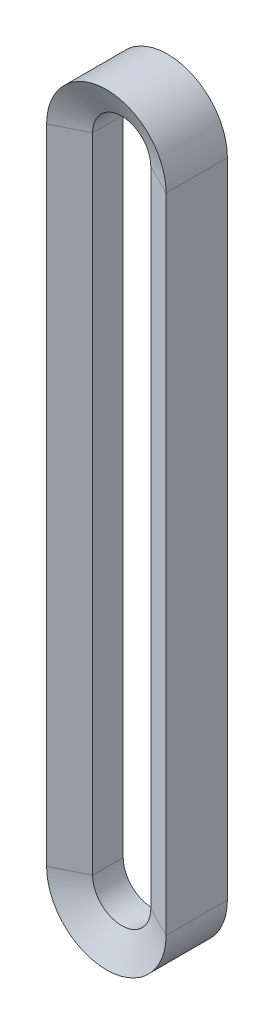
SolidWorks part; units mm, degrees
ref_plane "Front Plane" through (0, 0, 0) normal (0, 0, 1) x (1, 0, 0)
ref_plane "Top Plane" through (0, 0, 0) normal (0, 1, 0) x (1, 0, 0)
ref_plane "Right Plane" through (0, 0, 0) normal (1, 0, 0) x (0, 0, -1)
sketch "Sketch2" plane through (0, 0, 0) normal (0, 0, 1) x (1, 0, 0)
  line L0 (0, 0) -> (1, 0) construction
  line L1 (0, 0) -> (0, 1) construction
  line L2 (12.065, 0) -> (12.065, -266.4821)
  line L3 (-12.065, -266.4821) -> (-12.065, 0)
  arc A0 (-12.065, 0) -> (12.065, 0) centre (0, 0) cw
  arc A1 (12.065, -266.4821) -> (-12.065, -266.4821) centre (0, -266.4821) cw
sketch "Sketch3" plane through (0, 0, 0) normal (0, 1, 0) x (1, 0, 0)
  line L0 (12.065, -6.35) -> (12.065, 6.35)
  line L1 (12.065, 6.35) -> (24.765, 12.7)
  line L2 (24.765, 12.7) -> (24.765, -12.7)
  line L3 (24.765, -12.7) -> (12.065, -6.35)
  line L4 (-12.065, 0) -> (12.065, 0) construction
  dimension "D1" = 12.7
  dimension "D2" = 25.4
  dimension "D3" = 12.7
  dimension "D4" = 12.065
  dimension "D5" = 6.35
sweep "Sweep1" add profiles "Sketch3" path "Sketch2"
